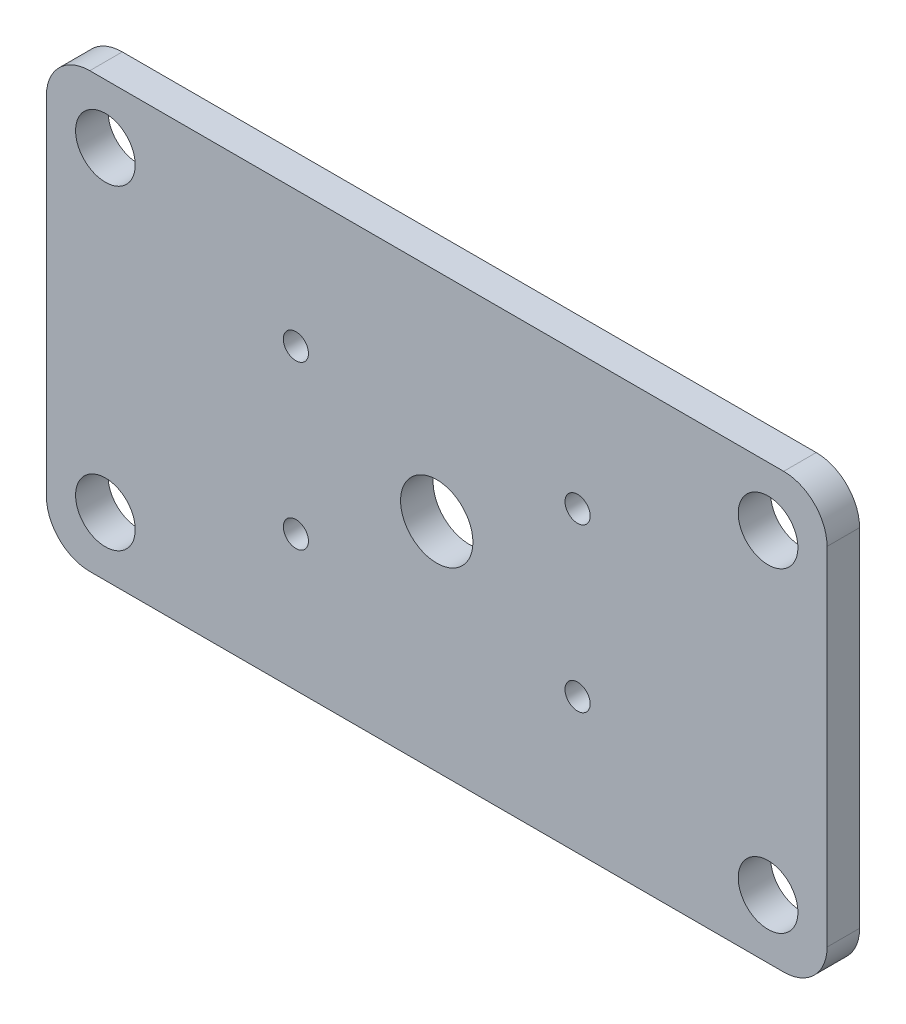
SolidWorks part; units mm, degrees
ref_plane "Front Plane" through (0, 0, 0) normal (0, 0, 1) x (1, 0, 0)
ref_plane "Top Plane" through (0, 0, 0) normal (0, 1, 0) x (1, 0, 0)
ref_plane "Right Plane" through (0, 0, 0) normal (1, 0, 0) x (0, 0, -1)
ref_plane "Plane1" through (0, 0, 4.7625) normal (0, 0, 1) x (1, 0, 0)
sketch "Sketch1" plane through (0, 0, 4.7625) normal (0, 0, 1) x (1, 0, 0)
  line L0 (57.15, -25.4) -> (57.15, 25.4)
  line L1 (50.8, 31.75) -> (-50.8, 31.75)
  line L2 (-57.15, 25.4) -> (-57.15, -25.4)
  line L3 (-50.8, -31.75) -> (50.8, -31.75)
  circle A0 centre (-20.6222, 11.9063) radius 1.8415
  circle A1 centre (-20.6222, -11.9062) radius 1.8415
  circle A2 centre (20.6222, -11.9063) radius 1.8415
  circle A3 centre (20.6222, 11.9062) radius 1.8415
  circle A6 centre (48.514, -23.114) radius 4.3688
  circle A7 centre (48.514, 23.114) radius 4.3688
  circle A8 centre (-48.514, -23.114) radius 4.3688
  circle A9 centre (-48.514, 23.114) radius 4.3688
  circle A10 centre (0, 0) radius 5.2959
  arc A11 (57.15, 25.4) -> (50.8, 31.75) centre (50.8, 25.4) ccw
  arc A12 (-50.8, 31.75) -> (-57.15, 25.4) centre (-50.8, 25.4) ccw
  arc A13 (-57.15, -25.4) -> (-50.8, -31.75) centre (-50.8, -25.4) ccw
  arc A14 (50.8, -31.75) -> (57.15, -25.4) centre (50.8, -25.4) ccw
extrude "Boss-Extrude1" add sketch "Sketch1" against normal blind 4.7625
